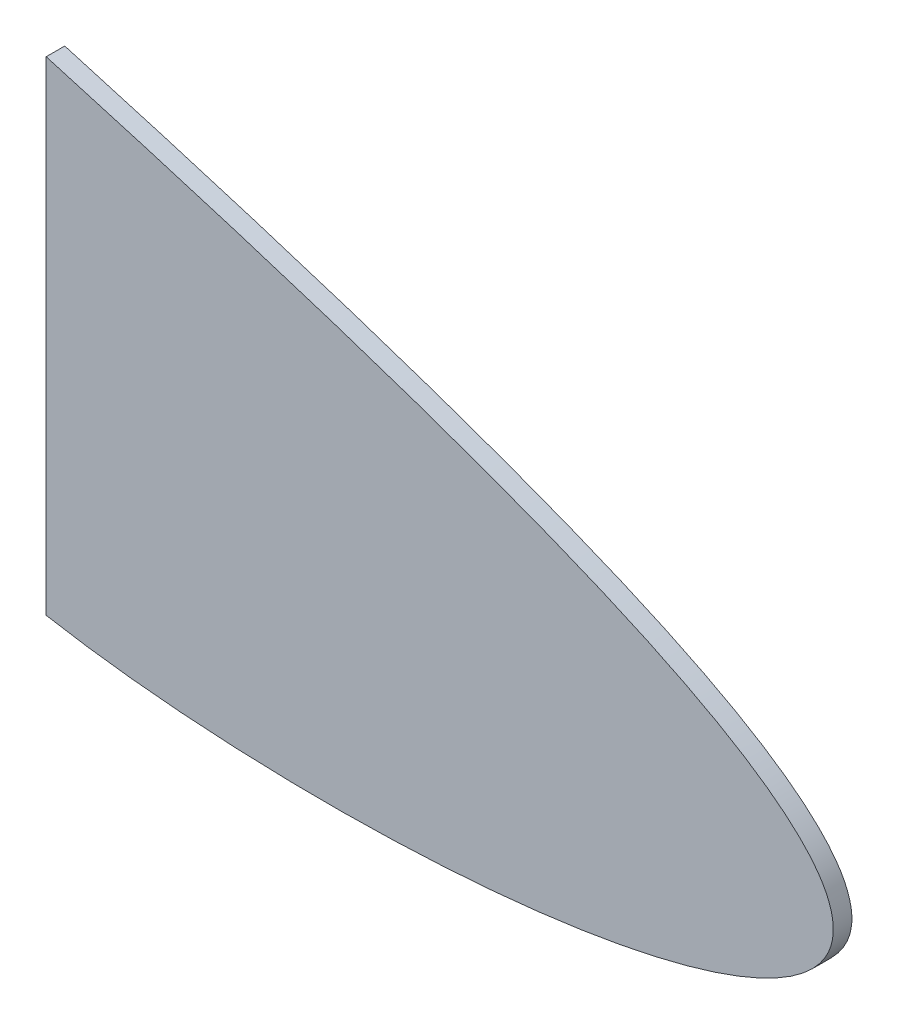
SolidWorks part; units mm, degrees
ref_plane "Front Plane" through (0, 0, 0) normal (0, 0, 1) x (1, 0, 0)
ref_plane "Top Plane" through (0, 0, 0) normal (0, 1, 0) x (1, 0, 0)
ref_plane "Right Plane" through (0, 0, 0) normal (1, 0, 0) x (0, 0, -1)
sketch "Sketch1" plane through (0, 0, 0) normal (0, 0, 1) x (1, 0, 0)
  line L0 (0, 0) -> (0, 31.75)
  line L1 (0, 31.75) -> (55.3934, 15.875) construction
  line L2 (55.3934, 15.875) -> (62.6221, 9.0834) construction
  line L3 (62.6221, 9.0834) -> (58.8982, 0) construction
  line L4 (58.8982, 0) -> (35.0218, -2.5262) construction
  line L5 (35.0218, -2.5262) -> (13.9929, -2.5262) construction
  line L6 (13.9929, -2.5262) -> (0, 0) construction
  spline_without_curve S0
  dimension "D1" = 31.75
base flange "Base-Flange1" sketch "Sketch1" thickness 1.2192 reverse thickness direction no parameters "D1"=0.7366
scale "Scale1" scale about centroid uniform scaling yes scale factor 0.5
sketch "Bend-Lines1" [suppressed] plane through (0, 0, 0) normal (0, 1, 0) x (1, 0, 0)
sketch "Bounding-Box1" [suppressed] plane through (0, 0, 0) normal (0, 1, 0) x (1, 0, 0)
sheet metal parameters "Sheet-Metal1" thickness 1.2192 parameters "D1"=0.7366
flat pattern "Flat-Pattern1"
sketch "Bend-Lines2" plane through (0, 0, 0) normal (0, 1, 0) x (1, 0, 0)
sketch3d "Bounding-Box2" [suppressed]
  line L0 (-47.7959, 28.4656, 0) -> (5.1308, 25.2058, 0) construction
  line L1 (-49.7786, -3.7257, 0) -> (3.1481, -6.9855, 0) construction
  line L2 (-47.7959, 28.4656, 0) -> (-49.7786, -3.7257, 0) construction
  line L3 (5.1308, 25.2058, 0) -> (3.1481, -6.9855, 0) construction
sheet metal parameters "Sheet-Metal2" thickness 1.2192 parameters "D1"=0.7366
flat pattern "Flat-Pattern1"
sketch "Bend-Lines2" plane through (0, 0, 0) normal (0, 1, 0) x (1, 0, 0)
sketch3d "Bounding-Box2" [suppressed]
  line L0 (-47.7959, 28.4656, 0) -> (5.1308, 25.2058, 0) construction
  line L1 (-49.7786, -3.7257, 0) -> (3.1481, -6.9855, 0) construction
  line L2 (-47.7959, 28.4656, 0) -> (-49.7786, -3.7257, 0) construction
  line L3 (5.1308, 25.2058, 0) -> (3.1481, -6.9855, 0) construction
